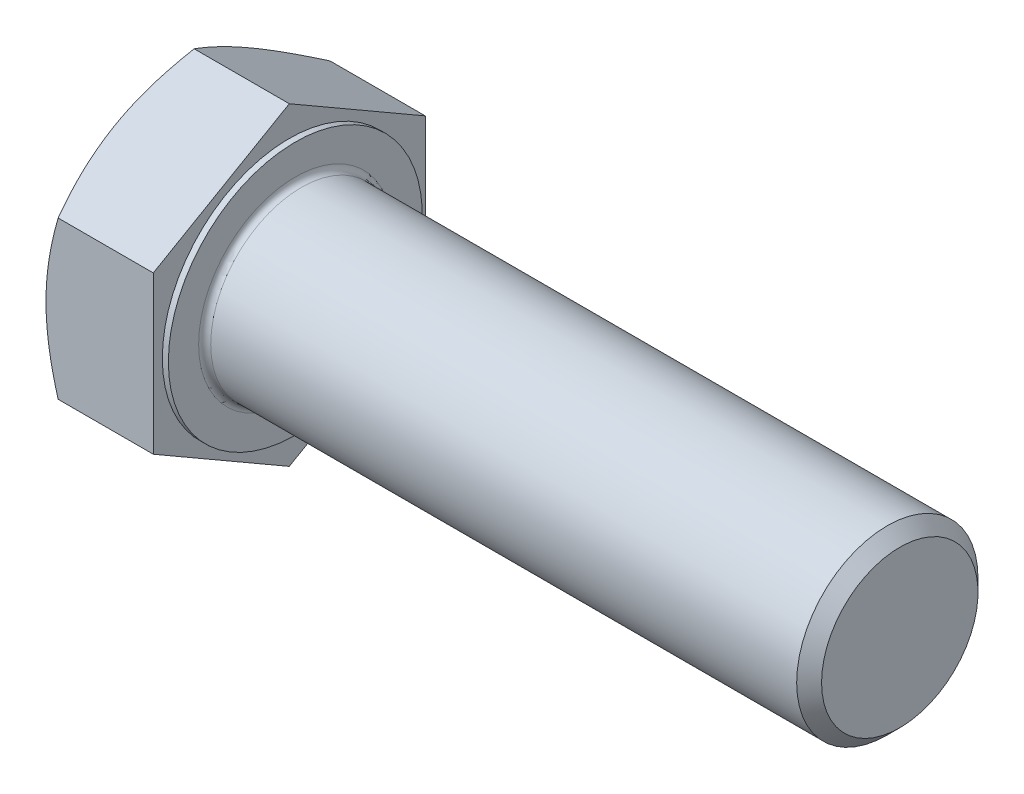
SolidWorks part; units mm, degrees
ref_plane "Front Plane" through (0, 0, 0) normal (0, 0, 1) x (1, 0, 0)
ref_plane "Top Plane" through (0, 0, 0) normal (0, 1, 0) x (1, 0, 0)
ref_plane "Right Plane" through (0, 0, 0) normal (1, 0, 0) x (0, 0, -1)
sketch "BaseHeadSke" plane through (0, 0, 0) normal (1, 0, 0) x (0, 0, -1)
  line L1 (18, 10.3923) -> (0, 20.7846)
  line L2 (0, 20.7846) -> (-18, 10.3923)
  line L3 (-18, 10.3923) -> (-18, -10.3923)
  line L4 (-18, -10.3923) -> (0, -20.7846)
  line L5 (0, -20.7846) -> (18, -10.3923)
  line L6 (18, -10.3923) -> (18, 10.3923)
  circle A0 centre (0, 0) radius 18 construction
  dimension "Width_flats" = 36
extrude "BaseHead" add sketch "BaseHeadSke" along normal blind 15
sketch "BodySke" plane through (0, 0, 0) normal (0, 0, 1) x (1, 0, 0)
  line L0 (0, 0) -> (95, 0)
  line L1 (95, 0) -> (95, 10.352)
  line L2 (95, 10.352) -> (93.352, 12)
  line L3 (93.352, 12) -> (0, 12)
  line L4 (0, 12) -> (0, 0)
  line L5 (15, 10.3923) -> (15, -10.3923) construction
  line L6 (0, 0) -> (159.3976, 0) construction
  line L7 (15, -84.3176) -> (15, 77.7215) construction
  line L8 (92, -21.5941) -> (92, 39.2994) construction
  dimension "Ang" = 45
  dimension "Length" = 80
  dimension "Diameter" = 24
  dimension "Minor_dia" = 20.704
  dimension "Thread_length" = 80
  dimension "Advance" = 3
revolve "BaseBody" add sketch "BodySke" angle 360 about L6
sketch "HeadChamferSke" plane through (0, 0, 0) normal (0, 0, 1) x (1, 0, 0)
  line L0 (1.6077, 20.7846) -> (0, 20.7846)
  line L1 (0, 20.7846) -> (0, 18)
  line L2 (0, 18) -> (1.6077, 20.7846)
  line L3 (0, 0) -> (120.9185, 0) construction
  dimension "D1" = 30
  dimension "Head_chamfer" = 36
revolve "HeadChamfer" cut sketch "HeadChamferSke" angle 360 about L3
sketch "BearingFaceSke" plane through (0, 0, 0) normal (0, 0, 1) x (1, 0, 0)
  line L0 (0, 0) -> (129.6443, 0) construction
  line L1 (14.2, 20.7846) -> (15, 20.7846)
  line L2 (14.2, 20.7846) -> (14.2, 16.805)
  line L3 (14.2, 16.805) -> (15, 16.805)
  line L4 (15, 20.7846) -> (15, 16.805)
  dimension "Bearing_height" = 0.8
  dimension "Dw" = 33.61
revolve "BearingFace" cut sketch "BearingFaceSke" angle 360 about L0
fillet "Fillet" radius 0.8 1 edges at (15, 0, 12)
sketch "ThdSchSke" plane through (0, 0, 0) normal (0, 0, 1) x (1, 0, 0)
  line L0 (91.0485, 13.9029) -> (91.0485, 12)
  line L1 (91.0485, 12) -> (92, 10.352)
  line L2 (92, 10.352) -> (92.9515, 12)
  line L3 (92.9515, 12) -> (92.9515, 13.9029)
  line L4 (92.9515, 13.9029) -> (91.0485, 13.9029)
  line L6 (0, 0) -> (141.9934, 0) construction
  line L7 (95, -10.352) -> (95, 10.352) construction
  dimension "D2" = 20.704
  dimension "D3" = 24
  dimension "Advance" = 3
revolve "ThreadSchematic" [suppressed] cut sketch "ThdSchSke" angle 360 about L6
pattern_linear "ThdSchPat" [suppressed] count 25 spacing 3 along (1, 0, 0)
equation "\"Thread_minor@ThreadCosmetic\" = \"Minor_dia@BodySke\""
equation "\"Thread_length@ThreadCosmetic\" = \"Thread_length@BodySke\""
equation "\"Head_chamfer@HeadChamferSke\" = \"Width_flats@BaseHeadSke\""
equation "\"D2@ThdSchSke\" = \"Minor_dia@BodySke\""
equation "\"D3@ThdSchSke\" = \"Diameter@BodySke\""
equation "\"Advance@ThdSchSke\" = \"Advance@BodySke\""
equation "\"D3@ThdSchPat\" = \"Advance@BodySke\""
equation "\"D1@ThdSchPat\" =  int( \"Thread_length@BodySke\"/\"Advance@BodySke\" )-1"
